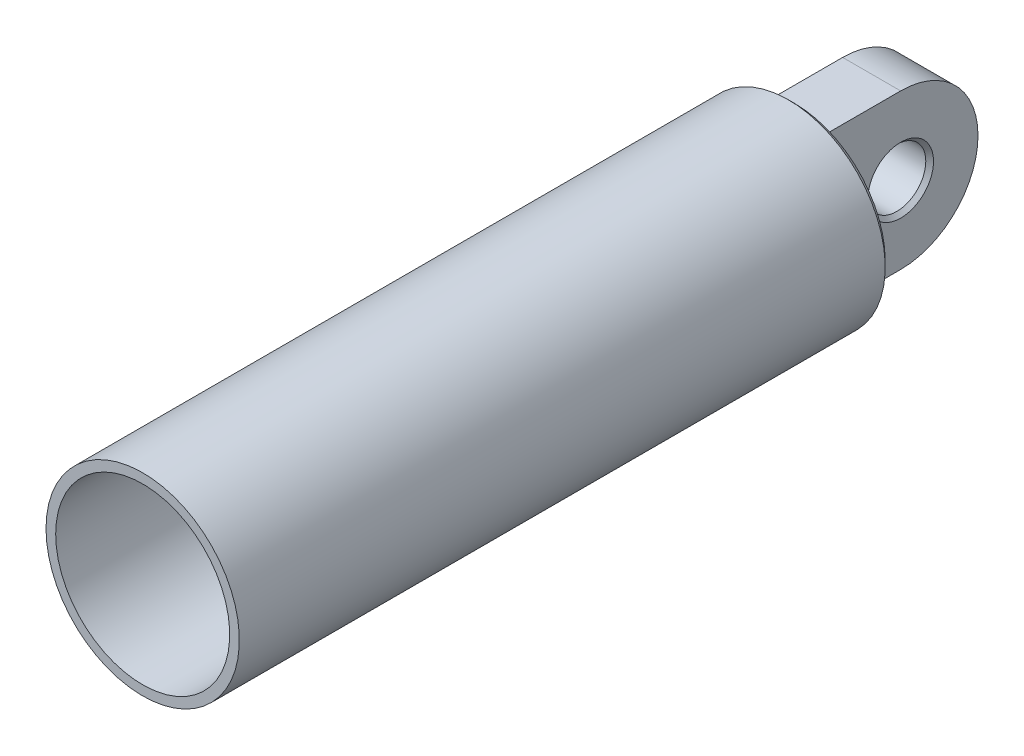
SolidWorks part; units mm, degrees
ref_plane "Plan de face" through (0, 0, 0) normal (0, 0, 1) x (1, 0, 0)
ref_plane "Plan de dessus" through (0, 0, 0) normal (0, 1, 0) x (1, 0, 0)
ref_plane "Plan de droite" through (0, 0, 0) normal (1, 0, 0) x (0, 0, -1)
sketch "Esquisse1" plane through (0, 0, 0) normal (0, 0, 1) x (1, 0, 0)
  circle A0 centre (0, 0) radius 50
  dimension "D1" = 100
extrude "Extru.-Mince1" add sketch "Esquisse1" along normal blind 327 thin
sketch "Esquisse2" plane through (0, 0, 0) normal (0, 0, -1) x (-1, 0, 0)
  circle A0 centre (0, 0) radius 50
extrude "Extrusion1" add sketch "Esquisse2" along normal blind 10
chamfer "Chanfrein1" distance 3 angle 45 1 edges at (-50, 0, -10)
sketch "Esquisse3" plane through (0, 0, -10) normal (0, 0, -1) x (-1, 0, 0)
  line L0 (0, 43.2554) -> (0, -43.2554) construction
  line L2 (-15, 40) -> (15, 40)
  line L3 (-15, 40) -> (-15, -40)
  line L4 (-15, -40) -> (15, -40)
  line L5 (15, 40) -> (15, -40)
  dimension "D1" = 80
  dimension "D2" = 40
  dimension "D3" = 30
  dimension "D4" = 15
extrude "Extrusion2" add sketch "Esquisse3" along normal blind 80
fillet "Congé1" radius 40 2 edges at (0, 40, -90) (0, -40, -90)
sketch "Esquisse4" plane through (15, 0, 0) normal (1, 0, 0) x (0, 0, -1)
  line L0 (10, 40) -> (10, -40) construction
  circle A0 centre (50, 0) radius 15
  dimension "D1" = 30
  dimension "D2" = 40
extrude "Enlèv. mat.-Extru.1" cut sketch "Esquisse4" against normal through all
chamfer "Chanfrein2" distance 2 angle 45 2 edges at (-15, 15, -50) (15, 15, -50)
